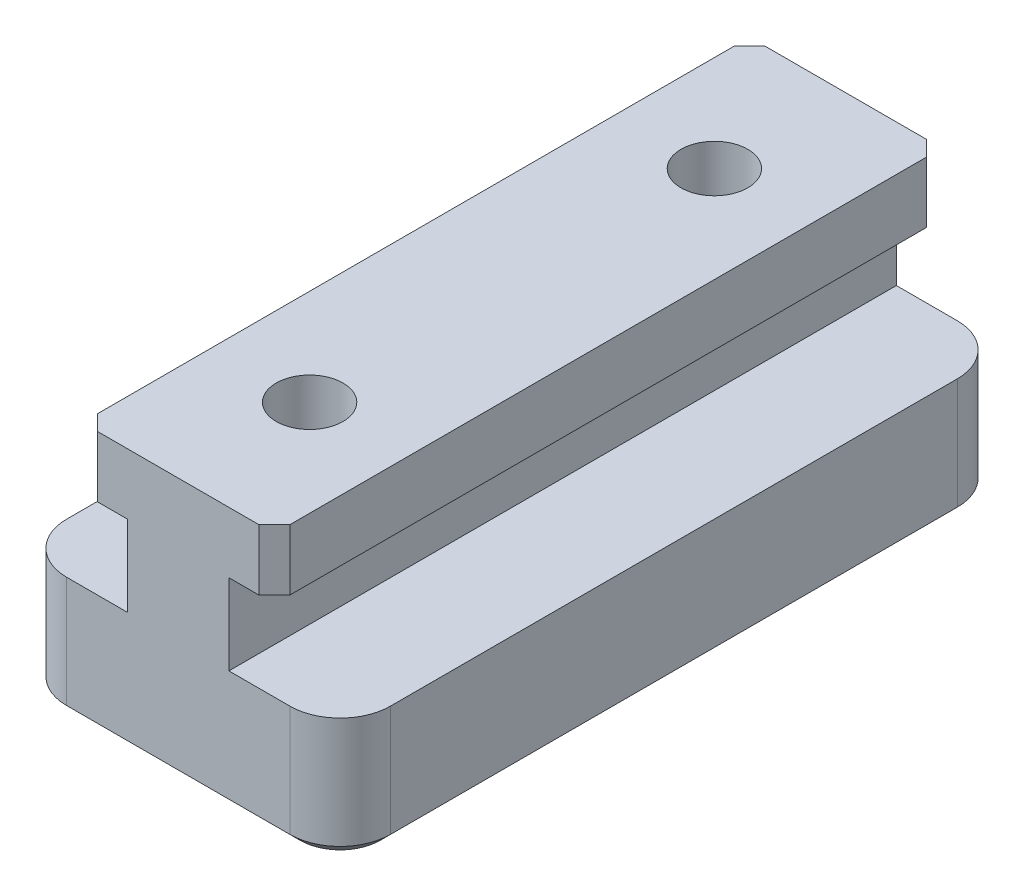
SolidWorks part; units mm, degrees
ref_plane "Front Plane" through (0, 0, 0) normal (0, 0, 1) x (1, 0, 0)
ref_plane "Top Plane" through (0, 0, 0) normal (0, 1, 0) x (1, 0, 0)
ref_plane "Right Plane" through (0, 0, 0) normal (1, 0, 0) x (0, 0, -1)
sketch "Sketch1" plane through (0, 0, 0) normal (0, 0, 1) x (1, 0, 0)
  line L0 (0, 0) -> (0, 6.3312) construction
  line L1 (4.7498, 5.0038) -> (-4.7498, 5.0038)
  line L2 (-4.7498, 5.0038) -> (-4.7498, 1.9916)
  line L3 (-4.7498, 1.9916) -> (-2.5019, 1.9916)
  line L4 (-2.5019, 1.9916) -> (-2.5019, -1.9962)
  line L5 (-2.5019, -1.9962) -> (-8, -1.9962)
  line L6 (-8, -1.9962) -> (-8, -7.9962)
  line L7 (-8, -7.9962) -> (8, -7.9962)
  line L9 (8, -1.9962) -> (8, -7.9962)
  line L10 (2.5019, -1.9962) -> (8, -1.9962)
  line L11 (2.5019, 1.9916) -> (2.5019, -1.9962)
  line L12 (4.7498, 1.9916) -> (2.5019, 1.9916)
  line L13 (4.7498, 5.0038) -> (4.7498, 1.9916)
  point P13 (0, -7.9962)
  point P18 (0, 5.0038)
  dimension "D1" = 9.4996
  dimension "D2" = 16
  dimension "D3" = 6
  dimension "D4" = 13
  dimension "D5" = 3.9878
  dimension "D6" = 5.0038
  dimension "D7" = 5.0038
  dimension "D8" = 1.9962
extrude "Boss-Extrude1" add sketch "Sketch1" along normal mid plane 32.98
fillet "Fillet1" radius 2.4892 4 edges at (-8, -4.9962, 16.49) (-8, -4.9962, -16.49) (8, -4.9962, -16.49) (8, -4.9962, 16.49)
chamfer "Chamfer1" distance 0.508 angle 45 8 edges at (0, -7.9962, -16.49) (-7.2709, -7.9962, -15.7609) (7.2709, -7.9962, -15.7609) (-8, -7.9962, 0) (8, -7.9962, 0) (-7.2709, -7.9962, 15.7609) (7.2709, -7.9962, 15.7609) (0, -7.9962, 16.49)
chamfer "Chamfer3" distance 0.762 angle 45 4 edges at (4.7498, 3.4977, -16.49) (-4.7498, 3.4977, -16.49) (-4.7498, 3.4977, 16.49) (4.7498, 3.4977, 16.49)
hole_wizard "M4x0.7 Tapped Hole1" positions "Sketch2" profile "Sketch4" tap size "M4x0.7" standard "ANSI Metric"
sketch "Sketch2" plane through (0, -7.9962, 0) normal (0, -1, 0) x (-1, 0, 0)
  line L0 (6.1406, 0) -> (-5.5042, 0) construction
  point P0 (0, 10)
  dimension "TS" = 10
sketch "Sketch4" plane through (0, -7.9962, -10) normal (1, 0, 0) x (0, 0, -1)
  line L0 (0, 0) -> (0, 13)
  line L1 (0, 13) -> (1.65, 13)
  line L2 (1.65, 13) -> (1.65, 0)
  line L5 (1.65, 0) -> (0, 0)
  line L11 (0, -6.35) -> (0, 107.95) construction
  dimension "Thru Tap Drill Dia." = 3.3
  dimension "Thru Tap Drill Depth" = 13
mirror "Mirror1" about plane through (0, 0, 0) normal (0, 0, 1) of "M4x0.7 Tapped Hole1"
